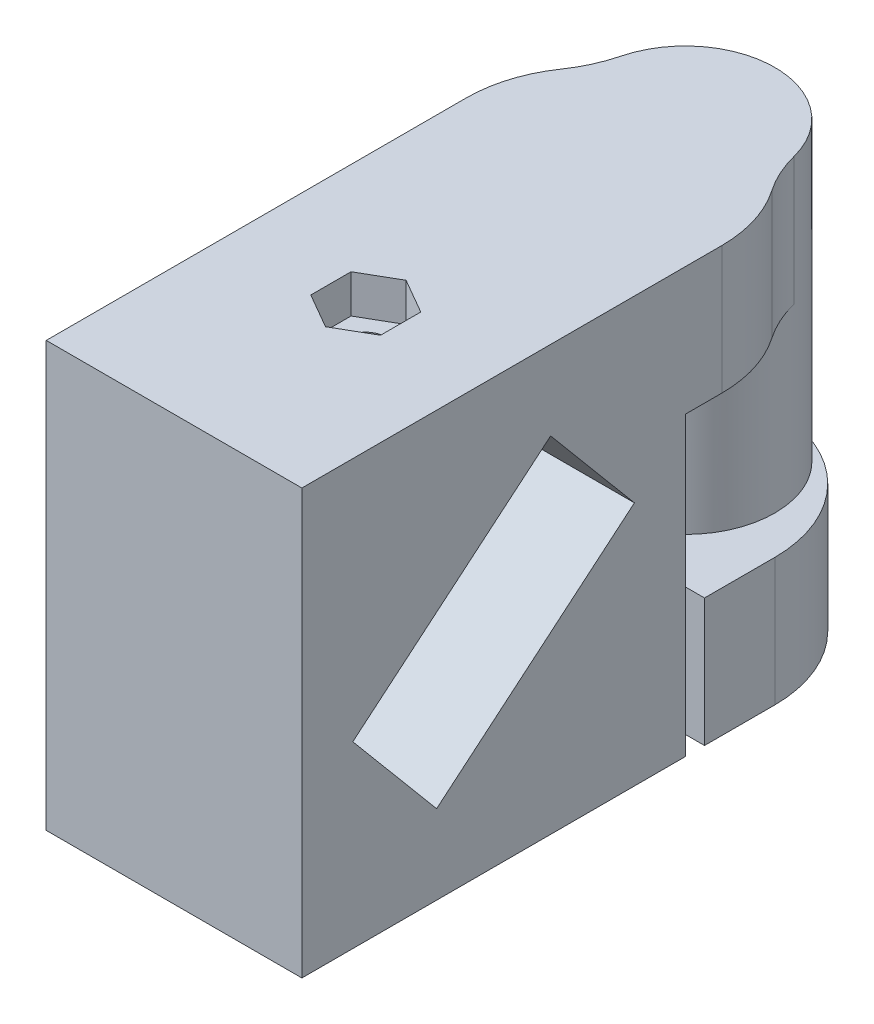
SolidWorks part; units mm, degrees
ref_plane "Спереди" through (0, 0, 0) normal (0, 0, 1) x (1, 0, 0)
ref_plane "Сверху" through (0, 0, 0) normal (0, 1, 0) x (1, 0, 0)
ref_plane "Справа" through (0, 0, 0) normal (1, 0, 0) x (0, 0, -1)
sketch "Эскиз1" plane through (0, 0, 0) normal (0, 1, 0) x (1, 0, 0)
  line L1 (-10, -15) -> (10, -15)
  line L2 (-10, -15) -> (-10, 15)
  line L3 (-10, 15) -> (10, 15)
  line L4 (10, -15) -> (10, 15)
  line L5 (-10, -15) -> (10, 15) construction
  line L6 (-10, 15) -> (10, -15) construction
  point P0 (0, 0)
  dimension "D1" = 20
  dimension "D2" = 30
extrude "Бобышка-Вытянуть1" add sketch "Эскиз1" along normal blind 33.2
sketch "Эскиз2" plane through (0, 33.2, 0) normal (0, 1, 0) x (1, 0, 0)
  line L0 (0, 15) -> (0, -15) construction
  line L1 (10, 15) -> (-10, 15) construction
  line L2 (-10, -15) -> (10, -15) construction
  circle A0 centre (0, 0) radius 1.5
  dimension "D1" = 3
extrude "Вырез-Вытянуть1" cut sketch "Эскиз2" against normal through all
sketch "Эскиз5" plane through (-10, 0, 0) normal (-1, 0, 0) x (0, 0, 1)
  line L0 (0, 33.2) -> (0, 0) construction
  line L2 (-15, 33.2) -> (15, 33.2) construction
  line L3 (15, 0) -> (-15, 33.2) construction
  line L4 (-4.4588, 26.999) -> (-11.0153, 19.1853)
  line L5 (-4.4588, 26.999) -> (11.0153, 14.0147)
  line L6 (11.0153, 14.0147) -> (4.4588, 6.201)
  line L7 (-11.0153, 19.1853) -> (4.4588, 6.201)
  line L8 (-4.4588, 26.999) -> (4.4588, 6.201) construction
  line L9 (11.0153, 14.0147) -> (-11.0153, 19.1853) construction
  point P5 (0, 16.6)
  point P6 (0, 16.6)
  dimension "D1" = 20.2
  dimension "D2" = 10.2
  dimension "D3" = 40
extrude "Вырез-Вытянуть4" cut sketch "Эскиз5" against normal blind 30
sketch "Sketch1" plane through (0, 0, -15) normal (0, 0, -1) x (-1, 0, 0)
  line L0 (0, 0) -> (0, 33.2) construction
  line L1 (-10, 0) -> (10, 0) construction
  line L2 (-10, 33.2) -> (10, 33.2) construction
  line L4 (-10, 23.2) -> (10, 23.2)
  line L5 (-10, 23.2) -> (-10, 33.2)
  line L6 (-10, 33.2) -> (10, 33.2)
  line L7 (10, 23.2) -> (10, 33.2)
  line L8 (-10, 23.2) -> (10, 33.2) construction
  line L9 (-10, 33.2) -> (10, 23.2) construction
  point P6 (0, 28.2)
  dimension "D1" = 10
extrude "Boss-Extrude2" add sketch "Sketch1" along normal blind 10
sketch "Sketch2" plane through (0, 23.2, 0) normal (0, -1, 0) x (1, 0, 0)
  line L0 (10, -25) -> (-10, -25) construction
  circle A0 centre (0, -25) radius 7
  dimension "D1" = 14
extrude "Boss-Extrude3" add sketch "Sketch2" along normal up to surface and the other way up to surface
fillet "Fillet1" radius 10 2 edges at (-10, 28.2, -25) (10, 28.2, -25)
sketch "Sketch3" plane through (0, 0, 0) normal (0, -1, 0) x (1, 0, 0)
  line L0 (10, -15) -> (-10, -15) construction
  line L1 (-10, -32) -> (10, -32)
  line L2 (-10, -32) -> (-10, -16.5)
  line L3 (-10, -16.5) -> (10, -16.5)
  line L4 (10, -32) -> (10, -16.5)
  line L5 (-10, -32) -> (10, -16.5) construction
  line L6 (-10, -16.5) -> (10, -32) construction
  line L7 (0, -15) -> (0, -32) construction
  circle A2 centre (0, -25) radius 7 construction
  point P0 (0, -24.25)
  dimension "D1" = 15.5
extrude "Boss-Extrude4" add sketch "Sketch3" against normal blind 10
fillet "Fillet2" radius 10 4 edges at (10, 5, -32) (-10, 5, -32) (7, 28.2, -25) (-7, 28.2, -25)
sketch "Sketch4" plane through (0, 0, 0) normal (0, -1, 0) x (1, 0, 0)
  circle A0 centre (0, 0) radius 3.15
  dimension "D1" = 6.3
extrude "Cut-Extrude1" cut sketch "Sketch4" against normal blind 3
sketch "Sketch5" plane through (0, 33.2, 0) normal (0, 1, 0) x (1, 0, 0)
  line L1 (0, 3.15) -> (-2.728, 1.575)
  line L2 (-2.728, 1.575) -> (-2.728, -1.575)
  line L3 (-2.728, -1.575) -> (0, -3.15)
  line L4 (0, -3.15) -> (2.728, -1.575)
  line L5 (2.728, -1.575) -> (2.728, 1.575)
  line L6 (2.728, 1.575) -> (0, 3.15)
  circle A0 centre (0, 0) radius 3.15 construction
extrude "Cut-Extrude2" cut sketch "Sketch5" against normal blind 3
